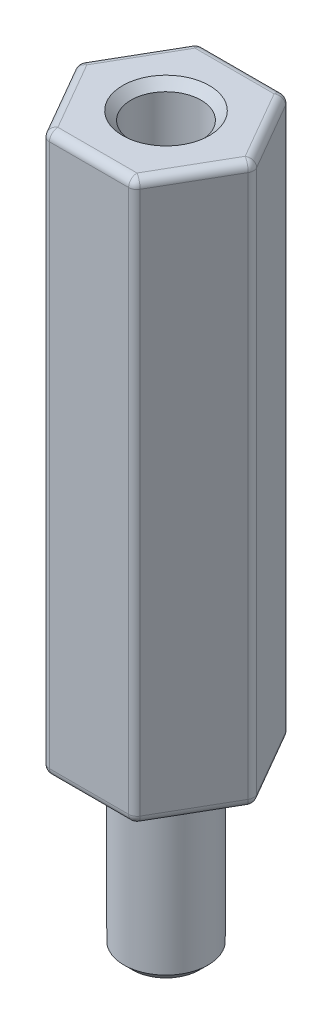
SolidWorks part; units mm, degrees
ref_plane "Front Plane" through (0, 0, 0) normal (0, 0, 1) x (1, 0, 0)
ref_plane "Top Plane" through (0, 0, 0) normal (0, 1, 0) x (1, 0, 0)
ref_plane "Right Plane" through (0, 0, 0) normal (1, 0, 0) x (0, 0, -1)
sketch "Sketch1" plane through (0, 0, 0) normal (0, 1, 0) x (1, 0, 0)
  line L1 (-1.5877, 2.75) -> (-3.1754, 0)
  line L2 (-3.1754, 0) -> (-1.5877, -2.75)
  line L3 (-1.5877, -2.75) -> (1.5877, -2.75)
  line L4 (1.5877, -2.75) -> (3.1754, 0)
  line L5 (3.1754, 0) -> (1.5877, 2.75)
  line L6 (1.5877, 2.75) -> (-1.5877, 2.75)
  circle A0 centre (0, 0) radius 2.75 construction
  circle A1 centre (0, 0) radius 1.25
  dimension "D2" = 2.5
  dimension "D1" = 5.5
extrude "Boss-Extrude1" add sketch "Sketch1" along normal blind 20
fillet "Fillet1" radius 0.3 6 edges at (1.5877, 10, -2.75) (3.1754, 10, 0) (-1.5877, 10, -2.75) (-3.1754, 10, 0) (-1.5877, 10, 2.75) (1.5877, 10, 2.75)
fillet "Fillet2" radius 0.3 24 edges at (-1.5645, 0, 2.7098) (-2.3816, 0, 1.375) (-3.129, 0, 0) (-2.3816, 0, -1.375) (-1.5645, 0, -2.7098) (0, 0, -2.75) (1.5645, 0, -2.7098) (2.3816, 0, -1.375) (3.129, 0, 0) (2.3816, 0, 1.375) (1.5645, 0, 2.7098) (-1.5645, 20, 2.7098) (-2.3816, 20, 1.375) (-3.129, 20, 0) (-2.3816, 20, -1.375) (-1.5645, 20, -2.7098) (0, 20, -2.75) (1.5645, 20, -2.7098) (2.3816, 20, -1.375) (3.129, 20, 0) (2.3816, 20, 1.375) (1.5645, 20, 2.7098) (0, 0, 2.75) (0, 20, 2.75)
sketch "Sketch2" plane through (0, 0, 0) normal (0, -1, 0) x (1, 0, 0)
  circle A0 centre (0, 0) radius 1.5
  dimension "D1" = 3
extrude "Boss-Extrude2" add sketch "Sketch2" along normal blind 6
chamfer "Chamfer1" distance 0.3 angle 45 2 edges at (0, 20, 1.25) (0, -6, -1.5)
fillet "Fillet3" radius 0.3 1 edges at (0, 0, 1.5)
